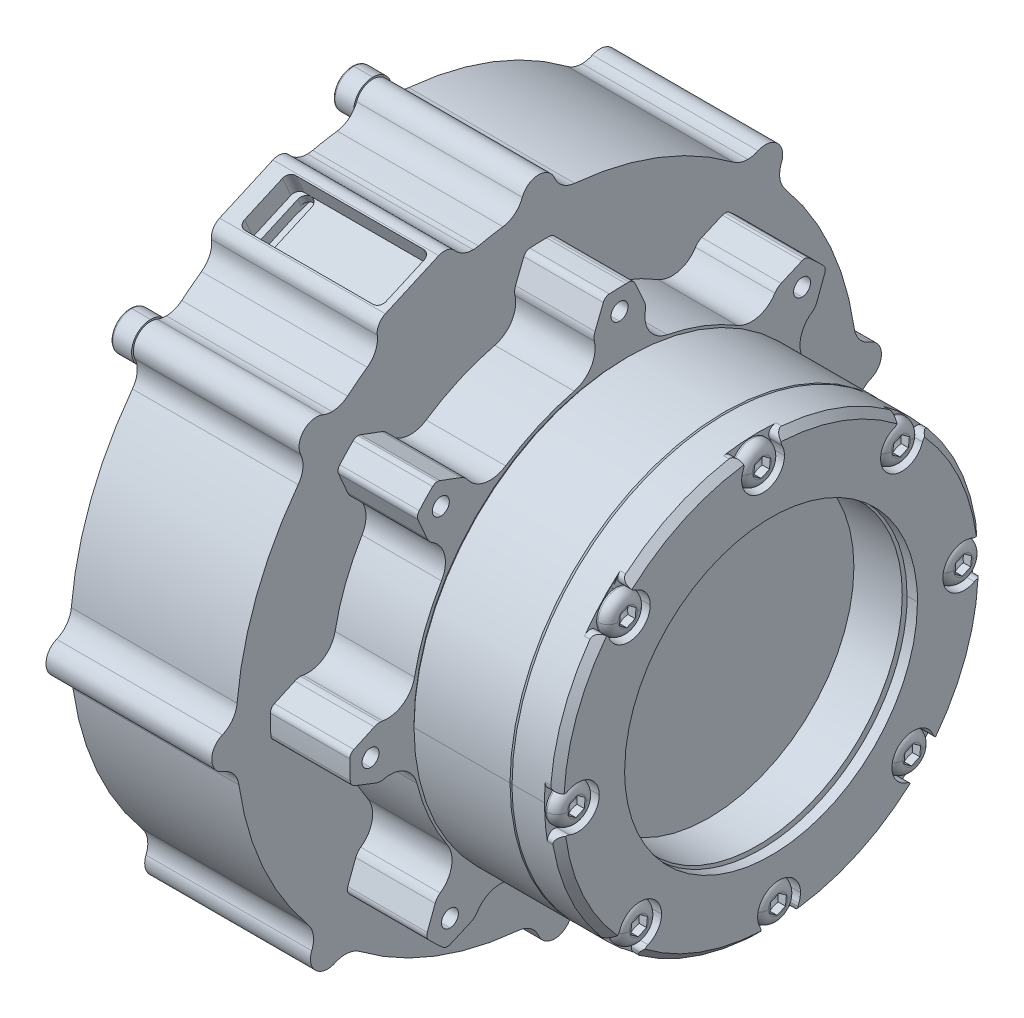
SolidWorks part; units mm, degrees
ref_plane "Alzado" through (0, 0, 0) normal (0, 0, 1) x (1, 0, 0)
ref_plane "Planta" through (0, 0, 0) normal (0, 1, 0) x (1, 0, 0)
ref_plane "Vista lateral" through (0, 0, 0) normal (1, 0, 0) x (0, 0, -1)
imported_body "GIM8108-48刹车安装尺寸图_25072201.STEP.step<1>"
sketch "Croquis3" plane through (-78.1843, 0, 0) normal (-1, 0, 0) x (0, 0, 1)
  line L1 (-28.65, 28.65) -> (28.65, 28.65)
  line L2 (-28.65, 28.65) -> (-28.65, -28.65)
  line L3 (-28.65, -28.65) -> (28.65, -28.65)
  line L4 (28.65, 28.65) -> (28.65, -28.65)
  line L5 (-28.65, 28.65) -> (28.65, -28.65) construction
  line L6 (-28.65, -28.65) -> (28.65, 28.65) construction
  point P0 (0, 0)
  dimension "D1" = 57.3
  dimension "D2" = 57.3
extrude "Cortar-Extruir3" cut sketch "Croquis3" against normal blind 25.1
sketch "Croquis4" plane through (-53.0843, 0, 0) normal (-1, 0, 0) x (0, 0, 1)
  circle A0 centre (0, 0) radius 28.5
  dimension "D1" = 57
extrude "Saliente-Extruir1" add sketch "Croquis4" along normal blind 11
sketch "Croquis5" plane through (-64.0843, 0, 0) normal (-1, 0, 0) x (0, 0, 1)
  line L0 (-22.6549, -17.2917) -> (2.3561, -28.4024)
  line L1 (15.6248, 45.5821) -> (23.349, 42.1507) construction
  circle A0 centre (0, 0) radius 28.5 construction
  circle A1 centre (0, 0) radius 28.5 construction
  arc A2 (-22.6549, -17.2917) -> (2.3561, -28.4024) centre (0, 0) ccw
  dimension "D1" = 53.5
extrude "Cortar-Extruir4" cut sketch "Croquis5" against normal blind 11
sketch "Croquis6" plane through (-64.0843, 0, 0) normal (-1, 0, 0) x (0, 0, 1)
  line L1 (-22.6549, -17.2917) -> (2.3561, -28.4024)
  line L2 (-22.6549, -17.2917) -> (2.3561, -28.4024)
  arc A1 (2.3561, -28.4024) -> (-22.6549, -17.2917) centre (0, 0) ccw
  arc A2 (2.3561, -28.4024) -> (-22.6549, -17.2917) centre (0, 0) ccw
  dimension "D1" = 0
chamfer "Chaflán1" distance 1 angle 45 1 edges at (-64.0843, 26.0457, 11.5703)
sketch "Sketch4" plane through (4.4157, 0, 0) normal (1, 0, 0) x (0, 0, -1)
  circle A0 centre (0, 0) radius 21
  arc A1 (-21, 0) -> (21, 0) centre (0, 0) ccw construction
extrude "Cut-Extrude1" cut sketch "Sketch4" against normal blind 10 and the other way through all
sketch "Sketch5" plane through (-17.5843, 0, 0) normal (1, 0, 0) x (0, 0, -1)
  line L0 (-36.9881, -0.9378) -> (36.9881, 0.9378)
sketch "Sketch6" plane through (-17.5843, 0, 0) normal (1, 0, 0) x (0, 0, -1)
  line L4 (-4.4916, 36.2584) -> (-3.2923, 39.2957)
  line L5 (-4.4916, 36.2584) -> (-3.2923, 39.2957)
  line L9 (2.6484, 36.4395) -> (1.2967, 39.412)
  line L10 (2.6484, 36.4395) -> (1.2967, 39.412)
  arc A16 (0, 40) -> (-2.4227, 39.9266) centre (0, 0) ccw
  arc A17 (-2.4227, 39.9266) -> (-3.2923, 39.2957) centre (-2.3622, 38.9284) ccw
  arc A18 (-4.4916, 36.2584) -> (-4.5794, 35.0707) centre (-2.6314, 35.5239) ccw
  arc A19 (-7.5122, 30.2821) -> (-4.5794, 35.0707) centre (-8.4753, 34.1644) ccw
  arc A20 (0, 40) -> (-2.4227, 39.9266) centre (0, 0) ccw
  arc A21 (-2.4227, 39.9266) -> (-3.2923, 39.2957) centre (-2.3622, 38.9284) ccw
  arc A22 (-4.4916, 36.2584) -> (-4.5794, 35.0707) centre (-2.6314, 35.5239) ccw
  arc A23 (-7.5122, 30.2821) -> (-4.5794, 35.0707) centre (-8.4753, 34.1644) ccw
  arc A36 (2.7963, 35.2577) -> (5.968, 30.6239) centre (6.7332, 34.55) ccw
  arc A37 (2.7963, 35.2577) -> (2.6484, 36.4395) centre (0.8278, 35.6116) ccw
  arc A38 (1.2967, 39.412) -> (0.3963, 39.998) centre (0.3864, 38.9981) ccw
  arc A39 (0.3963, 39.998) -> (0, 40) centre (0, 0) ccw
  arc A40 (2.7963, 35.2577) -> (5.968, 30.6239) centre (6.7332, 34.55) ccw
  arc A41 (2.7963, 35.2577) -> (2.6484, 36.4395) centre (0.8278, 35.6116) ccw
  arc A42 (1.2967, 39.412) -> (0.3963, 39.998) centre (0.3864, 38.9981) ccw
  arc A43 (0.3963, 39.998) -> (0, 40) centre (0, 0) ccw
  dimension "D3" = 4
  dimension "D4" = 2
  dimension "D6" = 1
  dimension "D7" = 40
  dimension "D9" = 3.4592
  dimension "D5" = 3.2654
  dimension "D8" = 13.4803
  dimension "D10" = 3.3865
  dimension "D11" = 2.8191
  dimension "D1" = 0
  dimension "D2" = 0
sketch "Sketch7" plane through (-53.0843, 0, 0) normal (-1, 0, 0) x (0, 0, 1)
  line L5 (15.7466, 45.8562) -> (23.4708, 42.4249)
  line L6 (15.7466, 45.8562) -> (23.4708, 42.4249)
  arc A17 (28.8245, 34.5565) -> (25.9704, 36.7497) centre (0, 0) ccw construction
  arc A22 (9.9254, 44.1993) -> (10.6266, 44.1215) centre (10.6266, 47.3215) ccw
  arc A23 (24.8175, 40.024) -> (26.1436, 36.9946) centre (27.9903, 39.608) ccw
  arc A24 (24.8175, 40.024) -> (23.4708, 42.4249) centre (22.537, 40.323) ccw
  arc A25 (15.7466, 45.8562) -> (13.0622, 45.246) centre (14.8128, 43.7543) ccw
  arc A26 (10.6266, 44.1215) -> (13.0622, 45.246) centre (10.6266, 47.3215) ccw
  arc A27 (9.9254, 44.1993) -> (10.6266, 44.1215) centre (10.6266, 47.3215) ccw
  arc A28 (24.8175, 40.024) -> (26.1436, 36.9946) centre (27.9903, 39.608) ccw
  arc A29 (24.8175, 40.024) -> (23.4708, 42.4249) centre (22.537, 40.323) ccw
  arc A30 (15.7466, 45.8562) -> (13.0622, 45.246) centre (14.8128, 43.7543) ccw
  arc A31 (10.6266, 44.1215) -> (13.0622, 45.246) centre (10.6266, 47.3215) ccw
  dimension "D2" = 3.2
  dimension "D3" = 2.3
  dimension "D6" = 48.3
  dimension "D4" = 8.452
  dimension "D5" = 8.452
  dimension "D1" = 0.3
